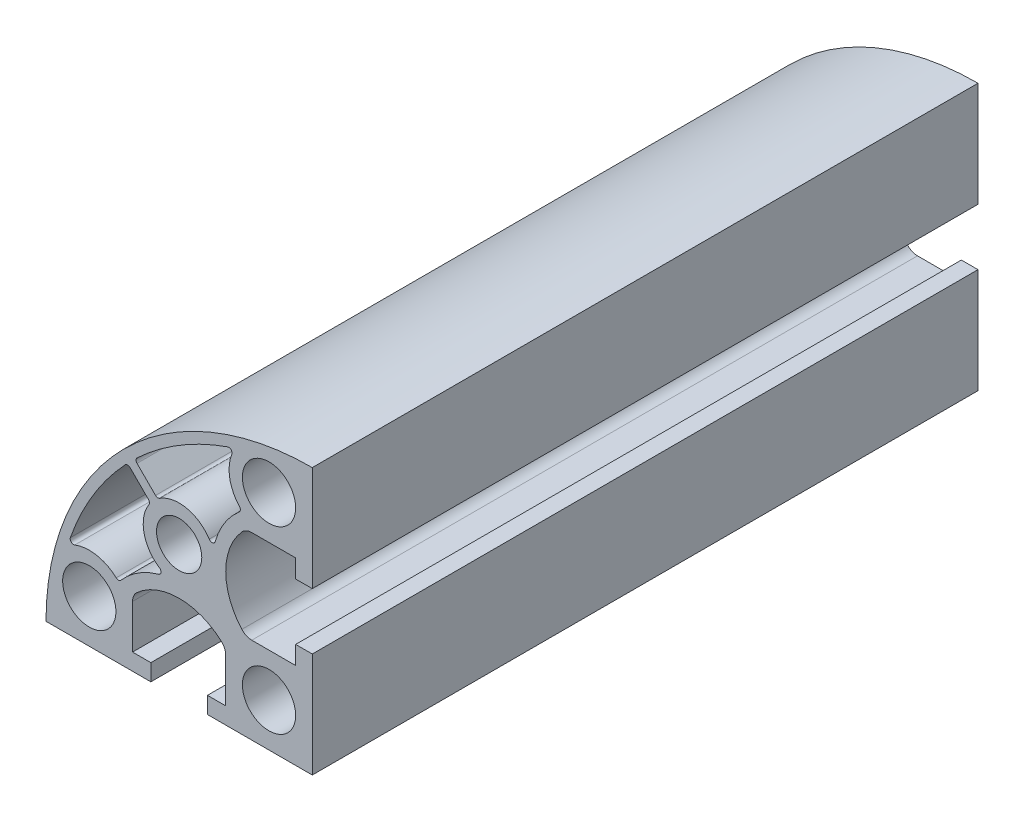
SolidWorks part; units mm, degrees
ref_plane "前基準面" through (0, 0, 0) normal (0, 0, 1) x (1, 0, 0)
ref_plane "上基準面" through (0, 0, 0) normal (0, 1, 0) x (1, 0, 0)
ref_plane "右基準面" through (0, 0, 0) normal (1, 0, 0) x (0, 0, -1)
sketch "草圖1" plane through (0, 0, 0) normal (0, 0, 1) x (1, 0, 0)
  line L0 (0, 53.2301) -> (0, -51.0629) construction
  line L2 (-20, 20) -> (20, 20)
  line L3 (-20, 20) -> (-20, -20)
  line L4 (-20, -20) -> (20, -20)
  line L5 (20, 20) -> (20, -20)
  line L6 (-20, 20) -> (20, -20) construction
  line L7 (-20, -20) -> (20, 20) construction
  point P3 (0, 0)
  dimension "D1" = 40
  dimension "D2" = 40
extrude "填料-伸長1" add sketch "草圖1" along normal mid plane 100
sketch "草圖2" plane through (0, 0, 50) normal (0, 0, 1) x (1, 0, 0)
  circle A0 centre (0, 0) radius 3.4
  dimension "D1" = 6.8
extrude "除料-伸長1" cut sketch "草圖2" against normal through all
sketch "草圖3" plane through (0, 0, 50) normal (0, 0, 1) x (1, 0, 0)
  circle A0 centre (-13.5, 13.5) radius 4
  circle A1 centre (0, 0) radius 3.4 construction
  dimension "D2" = 8
  dimension "D1" = 13.5
  dimension "D3" = 13.5
extrude "除料-伸長2" cut sketch "草圖3" against normal through all
pattern_circular "環狀複製排列1" count 4 over 360 about axis through (0, 0, 0) along (0, 0, 1) of "除料-伸長2"
sketch "草圖4" plane through (0, 0, 50) normal (0, 0, 1) x (1, 0, 0)
  line L0 (4.25, 20) -> (-4.25, 20)
  line L1 (20, 20) -> (-20, 20) construction
  line L2 (-4.25, 20) -> (-4.25, 17.5)
  line L3 (-4.25, 17.5) -> (-7, 17.5)
  line L4 (-7, 17.5) -> (-7, 10.9098)
  line L5 (0, 0) -> (0, 20) construction
  line L6 (7, 17.5) -> (7, 10.9098)
  line L7 (4.25, 17.5) -> (7, 17.5)
  line L8 (4.25, 20) -> (4.25, 17.5)
  arc A0 (-6.3333, 9.4191) -> (6.3333, 9.4191) centre (0, 16.5) ccw
  arc A1 (7, 10.9098) -> (6.3333, 9.4191) centre (5, 10.9098) cw
  arc A2 (-7, 10.9098) -> (-6.3333, 9.4191) centre (-5, 10.9098) ccw
  point P16 (7, 10.0774)
  point P19 (-7, 10.0774)
  dimension "D1" = 9.5
  dimension "D6" = 2
  dimension "D2" = 2.5
  dimension "D3" = 3.5
  dimension "D4" = 14
  dimension "D5" = 8.5
extrude "除料-伸長3" cut sketch "草圖4" against normal through all
pattern_circular "環狀複製排列2" count 4 over 360 about axis through (0, 0, 0) along (0, 0, 1) of "除料-伸長3"
sketch "草圖5" plane through (0, 0, 50) normal (0, 0, 1) x (1, 0, 0)
  line L0 (-13.5, 13.5) -> (-20, 20) construction
  line L1 (-15.7479, 16.8086) -> (-17.179, 18.2397)
  line L2 (-16.8086, 15.7479) -> (-18.2397, 17.179)
  line L3 (-12.9697, 14.0303) -> (-19.4697, 20.5303) construction
  line L4 (-14.0303, 12.9697) -> (-20.5303, 19.4697) construction
  circle A1 centre (-13.5, 13.5) radius 4 construction
  circle A2 centre (-13.5, 13.5) radius 6
  arc A3 (-17.179, 18.2397) -> (-18.2397, 17.179) centre (-13.5, 13.5) ccw construction
  arc A4 (-15.7479, 16.8086) -> (-16.8086, 15.7479) centre (-13.5, 13.5) ccw
  arc A5 (-17.179, 18.2397) -> (-18.2397, 17.179) centre (-17.7094, 17.7094) ccw
  dimension "D1" = 0.75
  dimension "D2" = 0.75
  dimension "D3" = 2
extrude "除料-伸長4" cut sketch "草圖5" against normal through all
pattern_circular "環狀複製排列3" count 4 over 360 about axis through (-13.5, 13.5, 0) along (0, 0, 1) of "除料-伸長4"
sketch "草圖7" plane through (0, 0, 50) normal (0, 0, 1) x (1, 0, 0)
  line L0 (20, 20) -> (-20, 20)
  line L2 (-20, -20) -> (-20, 20)
  arc A0 (20, 20) -> (-20, -20) centre (20, -20) ccw
extrude "除料-伸長6" cut sketch "草圖7" against normal through all
sketch "草圖8" plane through (0, 0, 50) normal (0, 0, 1) x (1, 0, 0)
  line L0 (7, 10.9098) -> (7, 17.5) construction
  line L1 (-17.5, -7) -> (-10.9098, -7) construction
  line L2 (7, 16.2388) -> (7, 17.5) construction
  line L3 (-17.5, -7) -> (-16.2388, -7) construction
  line L4 (7, 16.2388) -> (7, 17.8286)
  line L5 (-16.2388, -7) -> (-17.8286, -7)
  arc A0 (-9.7752, 6.7102) -> (9.2791, 18.5365) centre (20, -20) ccw construction
  arc A1 (-9.7752, 6.7102) -> (9.2791, 18.5365) centre (20, -20) ccw construction
  arc A2 (7, 17.8286) -> (-17.8286, -7) centre (20, -20) ccw
  arc A3 (7, 16.2388) -> (-16.2388, -7) centre (20, -20) ccw
  circle A4 centre (20, -20) radius 40 construction
  circle A5 centre (20, -20) radius 38.5 construction
  dimension "D1" = 1.5
extrude "填料-伸長2" add sketch "草圖8" against normal up to surface (100 mm away)
sketch "草圖9" plane through (0, 0, 50) normal (0, 0, 1) x (1, 0, 0)
  line L0 (-3.4648, 3.4648) -> (-8.2843, 8.2843) construction
  line L1 (-3.5469, 4.6076) -> (-6.3252, 7.3858)
  line L2 (-4.6076, 3.5469) -> (-7.3858, 6.3252)
  line L3 (-0.5303, -0.5303) -> (-8.8146, 7.7539) construction
  line L4 (0.5303, 0.5303) -> (-7.7539, 8.8146) construction
  line L5 (0, 0) -> (-8.2843, 8.2843) construction
  arc A0 (9.024, 8.7383) -> (5.4228, 3.0897) centre (16.5, 0) ccw
  arc A1 (20, 20) -> (-20, -20) centre (20, -20) ccw construction
  circle A2 centre (0, 0) radius 5.4
  arc A3 (4.5225, 2.9508) -> (-2.9227, 4.5407) centre (0, 0) ccw
  arc A4 (7.2809, 16.3383) -> (-6.3134, 8.1044) centre (20, -20) ccw
  arc A5 (-8.1044, 6.3134) -> (-16.3383, -7.2809) centre (20, -20) ccw
  arc A6 (-4.5407, 2.9227) -> (-2.9508, -4.5225) centre (0, 0) ccw
  arc A7 (7, 16.2388) -> (-5.5564, 8.7944) centre (20, -20) ccw construction
  circle A8 centre (13.5, 13.5) radius 6
  arc A9 (7.9118, 15.6844) -> (9.0682, 9.4553) centre (13.5, 13.5) ccw
  arc A10 (-8.7944, 5.5564) -> (-16.2388, -7) centre (20, -20) ccw construction
  circle A11 centre (-13.5, -13.5) radius 6
  arc A12 (-9.4553, -9.0682) -> (-15.6844, -7.9118) centre (-13.5, -13.5) ccw
  arc A13 (-8.7383, -9.024) -> (-3.0897, -5.4228) centre (0, -16.5) cw
  arc A14 (4.5225, 2.9508) -> (5.4228, 3.0897) centre (4.9412, 3.224) ccw
  arc A15 (9.0682, 9.4553) -> (9.024, 8.7383) centre (8.6989, 9.1183) cw
  arc A16 (7.2809, 16.3383) -> (7.9118, 15.6844) centre (7.4461, 15.8664) cw
  arc A17 (-6.3252, 7.3858) -> (-6.3134, 8.1044) centre (-5.9716, 7.7394) cw
  arc A18 (-8.7383, -9.024) -> (-9.4553, -9.0682) centre (-9.1183, -8.6989) cw
  arc A19 (-3.0897, -5.4228) -> (-2.9508, -4.5225) centre (-3.224, -4.9412) ccw
  arc A20 (-7.3858, 6.3252) -> (-8.1044, 6.3134) centre (-7.7394, 5.9716) ccw
  arc A21 (7.9284, 7.6667) -> (7.9284, -7.6667) centre (16.5, 0) ccw
  arc A22 (7.9284, 7.6667) -> (5.1261, 1.6981) centre (16.5, 0) ccw construction
  arc A23 (-16.3383, -7.2809) -> (-15.6844, -7.9118) centre (-15.8664, -7.4461) ccw
  arc A24 (-3.5469, 4.6076) -> (-2.9227, 4.5407) centre (-3.1933, 4.9611) ccw
  arc A25 (-4.6076, 3.5469) -> (-4.5407, 2.9227) centre (-4.9611, 3.1933) cw
  point P37 (9.4426, 9.0798)
  point P44 (-9.0798, -9.4426)
  point P47 (-1.6981, -5.1261)
  point P50 (-7.7488, 6.6881)
  point P62 (-4.3117, 3.251)
  dimension "D7" = 0.5
  dimension "D8" = 0.5
  dimension "D1" = 2
  dimension "D2" = 0.75
  dimension "D3" = 0.75
  dimension "D4" = 2
  dimension "D5" = 2
  dimension "D6" = 2
extrude "除料-伸長7" cut sketch "草圖9" against normal through all
